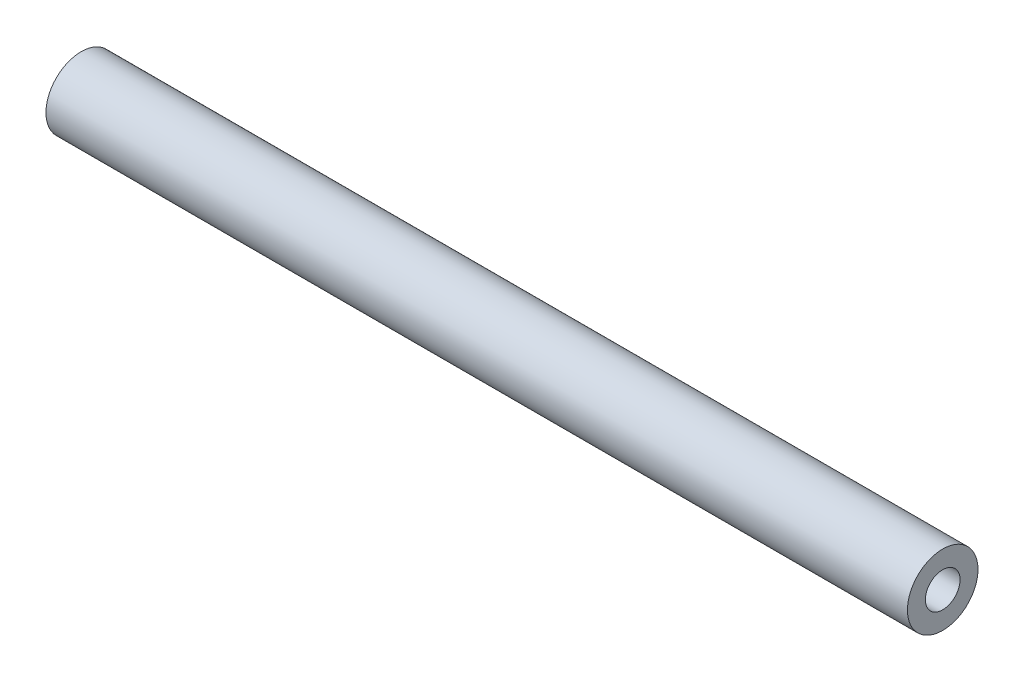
SolidWorks part; units mm, degrees
ref_plane "Front Plane" through (0, 0, 0) normal (0, 0, 1) x (1, 0, 0)
ref_plane "Top Plane" through (0, 0, 0) normal (0, 1, 0) x (1, 0, 0)
ref_plane "Right Plane" through (0, 0, 0) normal (1, 0, 0) x (0, 0, -1)
sketch "Sketch1" plane through (0, 0, 0) normal (1, 0, 0) x (0, 0, -1)
  circle A0 centre (0, 0) radius 6.35
  circle A1 centre (0, 0) radius 3.125
  dimension "D1" = 12.7
extrude "Boss-Extrude1" add sketch "Sketch1" along normal blind 155
